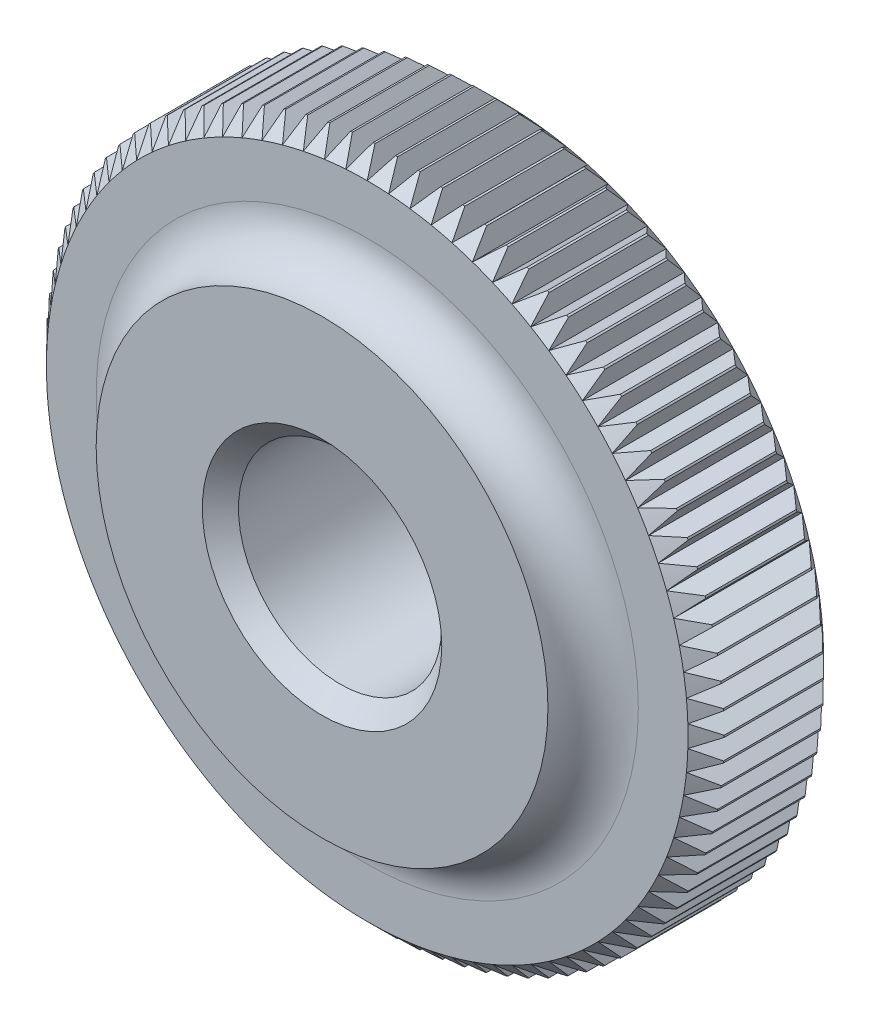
SolidWorks part; units mm, degrees
ref_plane "前视" through (0, 0, 0) normal (0, 0, 1) x (1, 0, 0)
ref_plane "上视" through (0, 0, 0) normal (0, 1, 0) x (1, 0, 0)
ref_plane "右视" through (0, 0, 0) normal (1, 0, 0) x (0, 0, -1)
other "Configuration Table"
sketch "Sketch1" plane through (0, 0, 0) normal (0, 0, 1) x (1, 0, 0)
  circle A0 centre (0, 0) radius 15
extrude "BaseNut" add sketch "Sketch1" against normal blind 6
sketch "Sketch2" plane through (2.2068, 1.9379, -6) normal (0, 0, -1) x (-1, 0, 0)
  circle A0 centre (2.2068, -1.9379) radius 10
  circle A1 centre (2.2068, -1.9379) radius 15 construction
  dimension "dw" = 20
extrude "Extrude1" add sketch "Sketch2" against normal blind 8
fillet "Fillet1" radius 2 1 edges at (10, 0, 0)
sketch "Sketch3" plane through (-1.1811, -0.1207, 2) normal (0, 0, 1) x (1, 0, 0)
  circle A0 centre (1.1811, 0.1207) radius 4.5
  circle A1 centre (1.1811, 0.1207) radius 10 construction
extrude "Hole1" cut sketch "Sketch3" against normal through all
sketch "Sketch4" plane through (0, 0, 0) normal (0, 1, 0) x (1, 0, 0)
  line L0 (0, 2.6341) -> (0, -9.703) construction
  line L2 (4.5, 6) -> (5.4, 6)
  line L5 (5.4, 6) -> (4.5, 5.1)
  line L7 (4.5, 5.1) -> (4.5, 6)
  dimension "Da" = 10.8
  dimension "D2" = 45
revolve "EndChamfer" [suppressed] cut sketch "Sketch4" angle 360 about L0
chamfer "Chamfer1" distance 0.8 angle 45 2 edges at (15, 0, -6) (15, 0, 0)
sketch "Sketch5" plane through (0, 6, -6) normal (0, 0, -1) x (1, 0, 0)
  line L0 (-0.25, 20.9979) -> (-0.25, 20.1978) construction
  line L1 (0, 22.5643) -> (0, 11.3282) construction
  line L2 (0.25, 20.9979) -> (0.25, 20.1978) construction
  line L4 (-0.6928, 21.4) -> (0, 20.2)
  line L5 (0, 20.2) -> (0.6928, 21.4)
  line L6 (0.6928, 21.4) -> (-0.6928, 21.4)
  circle A0 centre (0, 6) radius 14.2 construction
  arc A1 (0.25, 20.1978) -> (-0.25, 20.1978) centre (0, 6) ccw construction
  arc A2 (0.25, 20.9979) -> (-0.25, 20.9979) centre (0, 6) ccw construction
  circle A4 centre (0, 21) radius 0.4 construction
  circle A5 centre (0, 6) radius 15 construction
extrude "Cut-Extrude1" cut sketch "Sketch5" against normal through all
pattern_circular "CirPattern1" count 94 over 360 about axis through (0, 0, 0) along (0, 0, 1) of "Cut-Extrude1"
chamfer "Chamfer2" distance 0.8 angle 45 1 edges at (4.5, 0, 2)
sketch "Sketch7" plane through (0, 0, 0) normal (1, 0, 0) x (0, 0, -1)
  line L0 (13.2499, 0) -> (-8.3535, 0) construction
  line L1 (-0.95, -4) -> (-1.45, -4)
  line L2 (-1.45, -4) -> (-1.45, -4.5)
  line L3 (-1.45, -4.5) -> (-1.2, -4.933)
  line L4 (-1.2, -4.933) -> (-0.95, -4.5)
  line L5 (-0.95, -4.5) -> (-0.95, -4)
  line L6 (-1.2, -4.5) -> (-1.2, 4.5) construction
revolve "Cut-Revolve10" [suppressed] cut sketch "Sketch7" angle 360 about L0
pattern_linear "LPattern10" [suppressed] count 12 spacing 0.6 along (0, 0, 1)
equation "\"D2@Sketch5\" = \"dk@Sketch1\" / 30"
equation "\"D1@CirPattern1\" = int ( 3.14 / atn ( 2 * \"D2@Sketch5\" / \"dk@Sketch1\" )  ) "
equation "\"D1@Chamfer2\" = \"D1@Chamfer1\""
equation "\"D2@Sketch7\" = \"D1@Sketch3\""
equation "\"D1@Sketch7\" =  ( \"D2@ThreadCosmetic1\" - \"D1@Sketch3\" )  / 2"
equation "\"D3@LPattern10\" = \"D1@Sketch7\" * 1.2 "
equation "\"D1@LPattern10\" =\"m@Extrude1\" / \"D3@LPattern10\" - 1"
